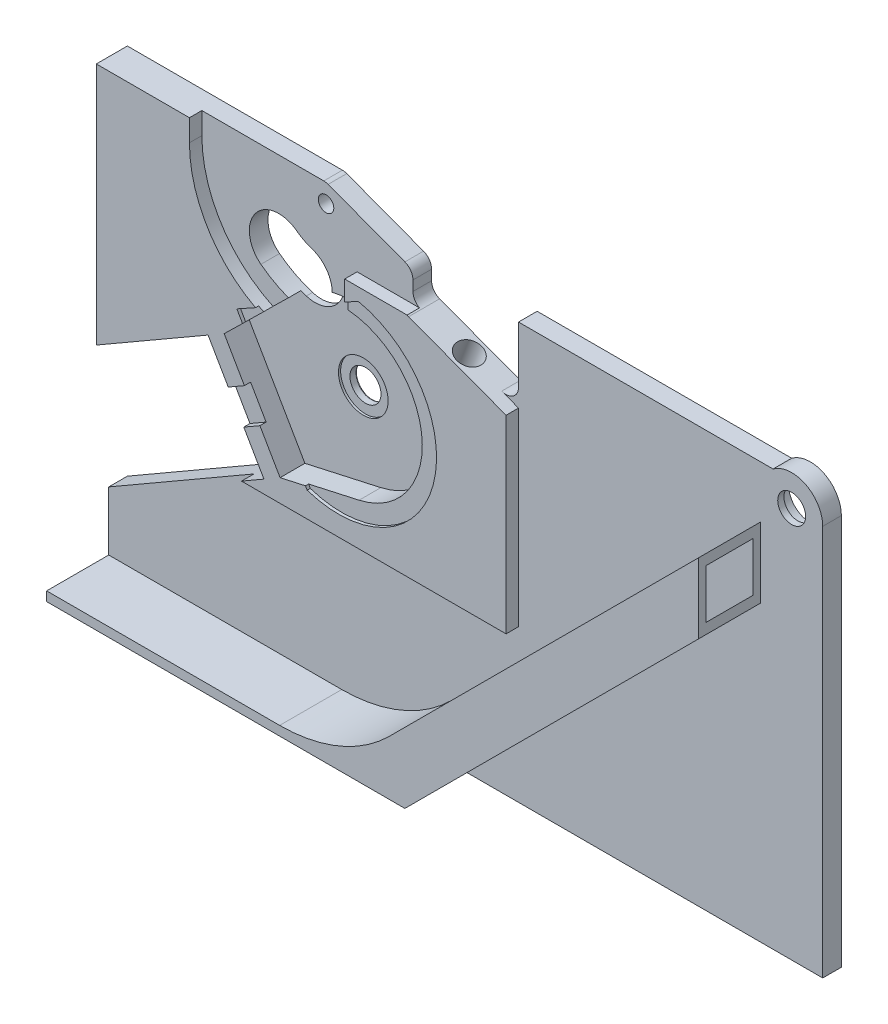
SolidWorks part; units mm, degrees
ref_plane "Plan de face" through (0, 0, 0) normal (0, 0, 1) x (1, 0, 0)
ref_plane "Plan de dessus" through (0, 0, 0) normal (0, 1, 0) x (1, 0, 0)
ref_plane "Plan de droite" through (0, 0, 0) normal (1, 0, 0) x (0, 0, -1)
sketch "Esquisse1" plane through (0, 0, 0) normal (0, 0, 1) x (1, 0, 0)
  line L1 (0, 0) -> (115, 0)
  line L2 (0, 0) -> (0, 67)
  line L3 (60, 67) -> (115, 67)
  line L4 (115, 0) -> (115, 67)
  line L6 (0, 67) -> (0, 71)
  line L7 (0, 71) -> (60, 71)
  line L8 (60, 67) -> (60, 71)
  dimension "D1" = 115
  dimension "D2" = 67
  dimension "D3" = 4
  dimension "D4" = 60
extrude "Boss.-Extru.1" add sketch "Esquisse1" along normal blind 3
sketch "Esquisse2" plane through (0, 0, 3) normal (0, 0, 1) x (1, 0, 0)
  line L0 (105, 47.3) -> (73.0509, 15.3509) construction
  line L1 (105, 72.7467) -> (105, 18.2483) construction
  line L2 (115, 0) -> (115, 67) construction
  line L3 (115, 67) -> (60, 67) construction
  line L4 (105, 58.6137) -> (54.5736, 8.1873) construction
  line L5 (105, 58.6137) -> (105, 47.3)
  line L6 (105, 47.3) -> (57.7, 0)
  line L7 (0, 0) -> (115, 0) construction
  line L8 (57.7, 0) -> (49.3005, 0)
  line L9 (105, 58.6137) -> (55.2086, 8.8223)
  line L11 (0, 0) -> (49.3005, 0)
  line L12 (0, 0) -> (0, 1.5)
  line L13 (0, 1.5) -> (37.531, 1.5)
  arc A0 (55.2086, 8.8223) -> (37.531, 1.5) centre (37.531, 26.5) cw
  dimension "D6" = 25
  dimension "D1" = 10
  dimension "D2" = 45
  dimension "D3" = 19.7
  dimension "D4" = 8
  dimension "D5" = 1.5
extrude "Boss.-Extru.2" add sketch "Esquisse2" along normal blind 10
ref_plane "Plan1" through (57.5, 57.5, 0) normal (-0.7071, -0.7071, 0) x (-0.7071, 0.7071, 0)
sketch "Esquisse3" plane through (112.0711, 2.9289, 0) normal (0.7071, 0.7071, 0) x (0, 0, -1)
  line L0 (-13, 36.3751) -> (-13, 44.3751) construction
  line L1 (-11.8, 43.1751) -> (-4.2, 43.1751)
  line L2 (-11.8, 43.1751) -> (-11.8, 37.5751)
  line L3 (-11.8, 37.5751) -> (-4.2, 37.5751)
  line L4 (-4.2, 43.1751) -> (-4.2, 37.5751)
  line L5 (-3, 36.3751) -> (-3, 44.3751) construction
  line L7 (-13, 44.3751) -> (-3, 44.3751) construction
  line L8 (-13, 36.3751) -> (-3, 36.3751) construction
  dimension "D1" = 1.2
  dimension "D2" = 1.2
  dimension "D3" = 1.2
  dimension "D4" = 1.2
extrude "Enlèv. mat.-Extru.1" cut sketch "Esquisse3" against normal mid plane 100
sketch "Esquisse5" plane through (0, 0, 4.2) normal (0, 0, 1) x (1, 0, 0)
  line L0 (48.0833, 0) -> (105, 56.9167) construction
  line L1 (0, 0) -> (115, 0) construction
  line L2 (55.4057, 7.3223) -> (48.0833, 0)
  line L3 (48.0833, 0) -> (37.728, 0)
  arc A0 (37.728, 0) -> (55.4057, 7.3223) centre (37.728, 25) ccw
  dimension "D1" = 25
extrude "Enlèv. mat.-Extru.2" cut sketch "Esquisse5" along normal up to surface (7.6 mm away)
sketch "Esquisse6" plane through (0, 0, 3) normal (0, 0, 1) x (1, 0, 0)
  line L0 (0, 11) -> (27, 26.5885)
  line L1 (0, 71) -> (0, 1.5) construction
  line L2 (27, 26.5885) -> (18, 42.1769)
  line L3 (18, 42.1769) -> (0, 31.7846)
  line L4 (0, 31.7846) -> (0, 11)
  line L5 (0, 0) -> (115, 0) construction
  dimension "D1" = 11
  dimension "D2" = 30
  dimension "D3" = 18
  dimension "D4" = 18
extrude "Enlèv. mat.-Extru.3" cut sketch "Esquisse6" against normal blind 10
sketch "Esquisse7" plane through (0, 0, 3) normal (0, 0, 1) x (1, 0, 0)
  line L0 (23.3827, 24.5) -> (66, 24.5)
  line L1 (66, 24.5) -> (66, 55)
  line L2 (66, 55) -> (50, 61)
  line L3 (50, 61) -> (21, 61)
  line L4 (0, 71) -> (0, 31.7846) construction
  line L5 (0, 60) -> (0, 31.7846)
  line L6 (18, 42.1769) -> (0, 31.7846) construction
  line L7 (0, 31.7846) -> (18, 42.1769)
  line L8 (18, 42.1769) -> (27, 26.5885)
  line L9 (27, 26.5885) -> (18, 42.1769) construction
  line L10 (27, 26.5885) -> (23.3827, 24.5)
  line L11 (0, 11) -> (27, 26.5885) construction
  line L12 (0, 0) -> (57.7, 0) construction
  line L13 (21, 61) -> (21, 71)
  line L14 (115, 67) -> (60, 67) construction
  line L15 (60, 71) -> (0, 71) construction
  line L16 (21, 71) -> (0, 71)
  line L17 (0, 71) -> (0, 60)
  dimension "D1" = 24.5
  dimension "D2" = 66
  dimension "D3" = 10
  dimension "D4" = 16
  dimension "D5" = 12
  dimension "D6" = 45
extrude "Boss.-Extru.4" add sketch "Esquisse7" along normal blind 2
sketch "Esquisse10" plane through (0, 0, 5) normal (0, 0, 1) x (1, 0, 0)
  line L0 (60, 71) -> (21, 71) construction
  line L1 (0, 71) -> (0, 31.7846) construction
  circle A0 centre (39, 43.5) radius 2.5
  dimension "D1" = 5
  dimension "D2" = 27.5
  dimension "D3" = 39
extrude "Enlèv. mat.-Extru.5" cut sketch "Esquisse10" against normal through all
sketch "Esquisse13" plane through (0, 0, 5) normal (0, 0, 1) x (1, 0, 0)
  line L0 (40, 71) -> (40, 48.1351)
  line L1 (0, 71) -> (0, 31.7846) construction
  line L5 (15, 67.5) -> (15, 71)
  line L7 (21, 71) -> (0, 71) construction
  line L8 (15, 71) -> (40, 71)
  arc A0 (15, 67.5) -> (40, 48.1351) centre (35, 67.5) ccw
  dimension "D2" = 3.5
  dimension "D4" = 20
  dimension "D1" = 40
  dimension "D3" = 35
extrude "Enlèv. mat.-Extru.6" cut sketch "Esquisse13" against normal up to surface (2 mm away)
hole_wizard "Trou taraudé M31" positions "Esquisse16" profile "Esquisse15" tap size "M3" standard "Iso"
sketch "Esquisse16" plane through (0, 0, 3) normal (0, 0, 1) x (1, 0, 0)
  line L0 (0, 71) -> (0, 31.7846) construction
  line L1 (60, 71) -> (15, 71) construction
  point P0 (35, 68)
  dimension "D1" = 35
  dimension "D2" = 3
sketch "Esquisse15" plane through (35, 68, 3) normal (1, 0, 0) x (0, -1, 0)
  line L0 (0, 0) -> (0, 3)
  line L1 (0, 3) -> (1.25, 3)
  line L2 (1.25, 3) -> (1.25, 0)
  line L5 (1.25, 0) -> (0, 0)
  line L11 (0, -6.35) -> (0, 107.95) construction
  dimension "Diamètre du trou pour taraudage jusqu'au prochain" = 2.5
  dimension "Profondeur du trou pour taraudage jusqu'au prochain" = 3
sketch "Esquisse18" plane through (0, 0, 3) normal (0, 0, 1) x (1, 0, 0)
  line L0 (35, 68) -> (31.25, 56.0758) construction
  line L1 (35, 68) -> (27.3978, 58.0775) construction
  line L2 (36, 72.6847) -> (36, 40.6428) construction
  line L3 (0, 71) -> (0, 31.7846) construction
  arc A0 (27.3978, 58.0775) -> (31.25, 56.0758) centre (35, 68) ccw construction
  arc A1 (24.509, 54.3069) -> (29.825, 51.5445) centre (35, 68) ccw
  arc A2 (30.2866, 61.848) -> (32.675, 60.607) centre (35, 68) ccw
  arc A3 (30.2866, 61.848) -> (24.509, 54.3069) centre (27.3978, 58.0775) ccw
  arc A4 (29.825, 51.5445) -> (32.675, 60.607) centre (31.25, 56.0758) ccw
  point P4 (29.2363, 56.9081)
  dimension "D1" = 12.5
  dimension "D2" = 4.75
  dimension "D3" = 20
  dimension "D4" = 36
extrude "Enlèv. mat.-Extru.7" cut sketch "Esquisse18" against normal blind 10
sketch "Esquisse19" plane through (0, 0, 0) normal (0, 0, -1) x (-1, 0, 0)
  line L0 (-66, 71) -> (-66, 55)
  line L1 (-66, 55) -> (-49, 61.375)
  line L2 (-49, 61.375) -> (-49, 65.75)
  line L3 (-49, 65.75) -> (-35, 71)
  line L4 (-60, 71) -> (0, 71) construction
  line L5 (-35, 71) -> (-66, 71)
  line L6 (0, 71) -> (0, 31.7846) construction
  line L7 (-66, 55) -> (-50, 61) construction
  line L8 (0, 71) -> (0, 31.7846) construction
  line L9 (-66, 24.5) -> (-66, 55) construction
  dimension "D2" = 49
  dimension "D3" = 35
extrude "Enlèv. mat.-Extru.9" cut sketch "Esquisse19" against normal blind 10
fillet "Congé3" radius 2 4 edges at (35, 71, 1.5) (49, 65.75, 1.5) (49, 61.375, 1.5) (66, 55, 1.5)
sketch "Esquisse20" plane through (0, 0, 5) normal (0, 0, 1) x (1, 0, 0)
  line L0 (20.5981, 43.6769) -> (29.5981, 28.0885)
  line L2 (0, 31.7846) -> (18, 42.1769) construction
  line L3 (0, 11) -> (23.3827, 24.5) construction
  line L4 (20.5981, 43.6769) -> (29.9055, 52.7892)
  line L5 (29.5981, 28.0885) -> (41.8251, 30.8107)
  line L6 (18, 42.1769) -> (27, 26.5885) construction
  arc A0 (41.8251, 30.8107) -> (29.9055, 52.7892) centre (39, 43.5) ccw
  circle A1 centre (39, 43.5) radius 2.5 construction
  dimension "D1" = 26
  dimension "D2" = 3
extrude "Enlèv. mat.-Extru.10" cut sketch "Esquisse20" against normal blind 4
sketch "Esquisse23" plane through (0, 0, 1) normal (0, 0, 1) x (1, 0, 0)
  circle A0 centre (39, 43.5) radius 4
  circle A1 centre (39, 43.5) radius 2.5 construction
  circle A2 centre (39, 43.5) radius 2.5
  dimension "D1" = 8
extrude "Enlèv. mat.-Extru.14" cut sketch "Esquisse23" against normal blind 0.35
sketch "Esquisse24" plane through (0, 0, 0) normal (0, 0, -1) x (-1, 0, 0)
  circle A0 centre (-39, 43.5) radius 2.5
  circle A1 centre (-39, 43.5) radius 2.5 construction
  circle A2 centre (-39, 43.5) radius 7
  dimension "D1" = 14
extrude "Boss.-Extru.7" add sketch "Esquisse24" along normal blind 0.5
fillet "Congé4" radius 0.2 2 edges at (36.5, 43.5, -0.5) (32, 43.5, -0.5)
sketch "Esquisse27" plane through (0, 0, 0) normal (0, 0, -1) x (-1, 0, 0)
  line L0 (-115, 67) -> (-66, 67) construction
  line L2 (-115, 0) -> (-115, 67) construction
  circle A0 centre (-110, 63) radius 5
  dimension "D1" = 10
  dimension "D2" = 4
extrude "Boss.-Extru.8" add sketch "Esquisse27" against normal blind 3
sketch "Esquisse28" plane through (0, 0, 0) normal (0, 0, -1) x (-1, 0, 0)
  circle A0 centre (-110, 63) radius 3.5
  arc A1 (-107, 67) -> (-113, 67) centre (-110, 63) ccw construction
  dimension "D1" = 7
extrude "Enlèv. mat.-Extru.16" cut sketch "Esquisse28" against normal blind 2
sketch "Esquisse29" plane through (0, 0, 2) normal (0, 0, -1) x (-1, 0, 0)
  circle A0 centre (-110, 63) radius 2.25
  dimension "D1" = 4.5
extrude "Enlèv. mat.-Extru.17" cut sketch "Esquisse29" against normal blind 2
sketch "Esquisse30" plane through (0, 0, 0) normal (0, 0, -1) x (-1, 0, 0)
  line L0 (-115, 67) -> (-113, 67) construction
  line L1 (-115, 0) -> (-115, 67) construction
  line L2 (-113, 67) -> (-115, 67)
  line L3 (-115, 67) -> (-115, 63)
  arc A0 (-113, 67) -> (-115, 63) centre (-110, 63) ccw
  arc A2 (-107, 67) -> (-113, 67) centre (-110, 63) ccw construction
extrude "Enlèv. mat.-Extru.18" cut sketch "Esquisse30" against normal through all
sketch "Esquisse36" plane through (0, 0, 5) normal (0, 0, 1) x (1, 0, 0)
  line L0 (42.1788, 58.9769) -> (22.6322, 48.1537)
  line L1 (22.6322, 48.1537) -> (33.9657, 28.5235)
  line L2 (18, 42.1769) -> (27, 26.5885) construction
  arc A0 (33.9657, 28.5235) -> (42.1788, 58.9769) centre (39, 43.5) ccw
  dimension "D1" = 15.8
  dimension "D2" = 7
  dimension "D3" = 12
extrude "Enlèv. mat.-Extru.24" cut sketch "Esquisse36" against normal blind 0.5
sketch "Esquisse37" plane through (26.2192, 69.9178, 0) normal (0.3511, 0.9363, 0) x (0.9363, -0.3511, 0)
  line L0 (39.5999, 0) -> (25.7159, 0) construction
  line L1 (42.4859, -5) -> (42.4859, -3) construction
  circle A0 centre (33.4859, -2.5) radius 2
  dimension "D1" = 2.5
  dimension "D2" = 4
  dimension "D3" = 9
extrude "Enlèv. mat.-Extru.25" cut sketch "Esquisse37" against normal blind 6
sketch "Esquisse38" plane through (0, 0, 5) normal (0, 0, 1) x (1, 0, 0)
  line L1 (21.25, 36.5477) -> (23.8481, 38.0477)
  line L2 (18, 42.1769) -> (27, 26.5885) construction
  line L3 (20.5981, 43.6769) -> (29.5981, 28.0885) construction
  line L4 (23.8481, 38.0477) -> (26.3481, 33.7176)
  line L6 (26.3481, 33.7176) -> (23.75, 32.2176)
  line L7 (23.75, 32.2176) -> (21.25, 36.5477)
  line L8 (0, 31.7846) -> (18, 42.1769) construction
  dimension "D1" = 6.5
  dimension "D2" = 5
extrude "Enlèv. mat.-Extru.26" cut sketch "Esquisse38" against normal blind 1
